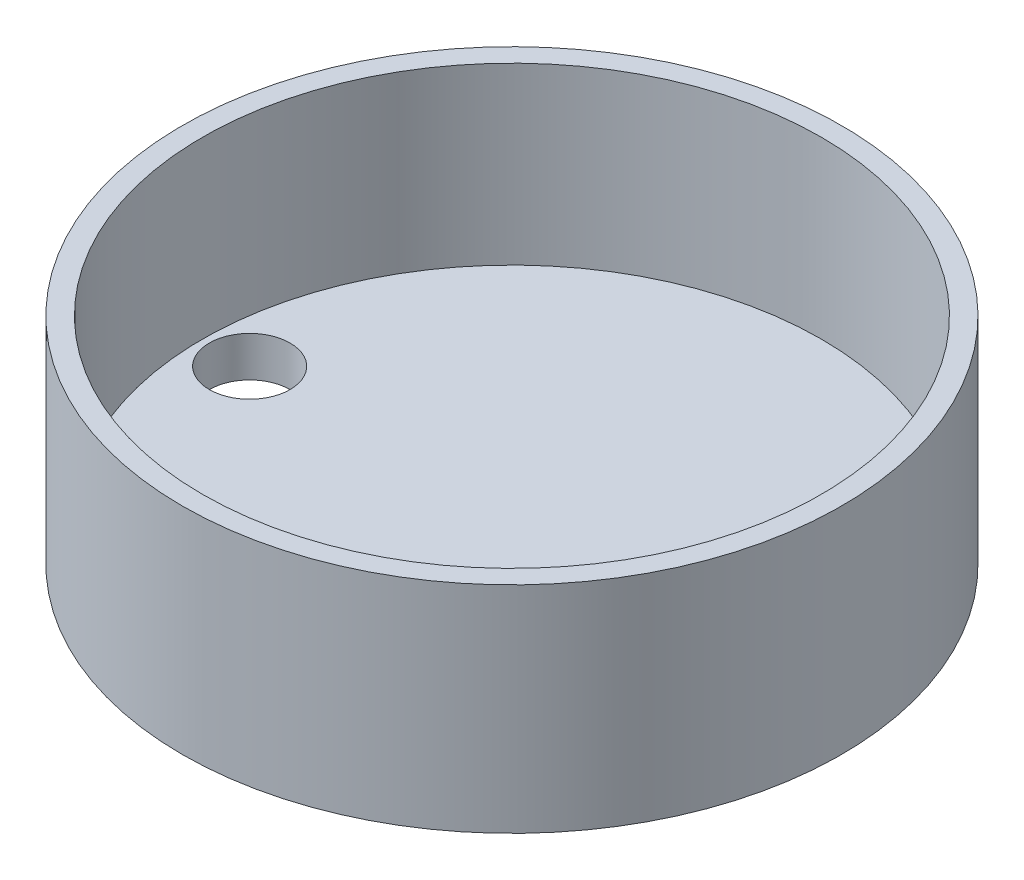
SolidWorks part; units mm, degrees
ref_plane "Front Plane" through (0, 0, 0) normal (0, 0, 1) x (1, 0, 0)
ref_plane "Top Plane" through (0, 0, 0) normal (0, 1, 0) x (1, 0, 0)
ref_plane "Right Plane" through (0, 0, 0) normal (1, 0, 0) x (0, 0, -1)
sketch "Sketch1" plane through (0, 0, 0) normal (0, 1, 0) x (1, 0, 0)
  circle A0 centre (0, 0) radius 77.7875
  dimension "D1" = 155.575
extrude "Boss-Extrude1" add sketch "Sketch1" against normal blind 50.8
sketch "Sketch2" plane through (0, 0, 0) normal (0, 1, 0) x (1, 0, 0)
  circle A0 centre (0, 0) radius 73.025
  dimension "D1" = 146.05
extrude "Cut-Extrude1" cut sketch "Sketch2" against normal blind 41.275
sketch "Sketch3" plane through (0, -50.8, 0) normal (0, -1, 0) x (1, 0, 0)
  circle A0 centre (61.8998, 0) radius 9.525
  circle A1 centre (-61.8998, 0) radius 9.525
  dimension "D1" = 19.05
  dimension "D2" = 19.05
  dimension "D3" = 61.8998
  dimension "D4" = 61.8998
extrude "Cut-Extrude2" cut sketch "Sketch3" against normal through all
